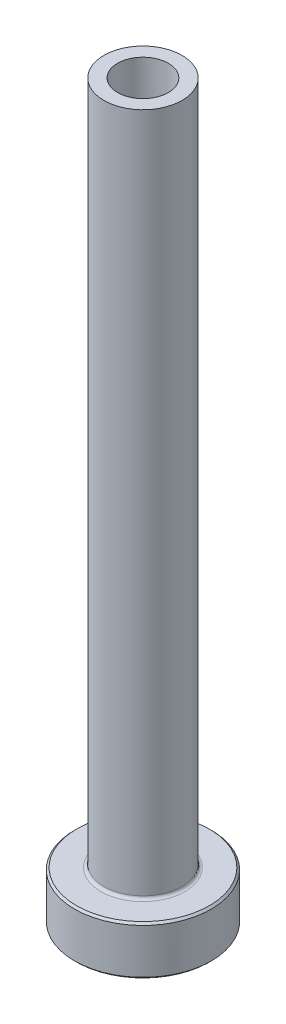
SolidWorks part; units mm, degrees
ref_plane "Front Plane" through (0, 0, 0) normal (0, 0, 1) x (1, 0, 0)
ref_plane "Top Plane" through (0, 0, 0) normal (0, 1, 0) x (1, 0, 0)
ref_plane "Right Plane" through (0, 0, 0) normal (1, 0, 0) x (0, 0, -1)
sketch "Sketch1" plane through (0, 0, 0) normal (0, 0, 1) x (1, 0, 0)
  line L0 (-2.6, 75) -> (-4, 75)
  line L1 (-4, 75) -> (-4, 5)
  line L2 (-4, 5) -> (-7, 5)
  line L3 (-7, 5) -> (-7, 0)
  line L4 (7.7, 0) -> (-7.7, 0) construction
  line L5 (-7, 0) -> (-2.85, 0)
  line L6 (-2.6, 30) -> (-2.6, 75)
  line L7 (0, 92.1877) -> (0, -15.5353) construction
  line L8 (0, -7.7) -> (0, 7.7) construction
  line L9 (-2.6, 30) -> (-2.85, 18)
  line L10 (-2.85, 18) -> (-2.85, 0)
  dimension "D1" = 0.25
  dimension "ID" = 5.2
  dimension "OD" = 8
  dimension "L" = 75
  dimension "H" = 14
  dimension "T" = 5
  dimension "N" = 45
  dimension "D2" = 12
revolve "Revolve1" add sketch "Sketch1" angle 360 about L7
fillet "Fillet1" radius 0.3 1 edges at (0, 5, 4)
chamfer "Chamfer1" distance 0.2 angle 45 2 edges at (0, 5, 7) (0, 0, 7)
chamfer "Chamfer3" distance 0.5 angle 45 1 edges at (0, 0, 2.85)
